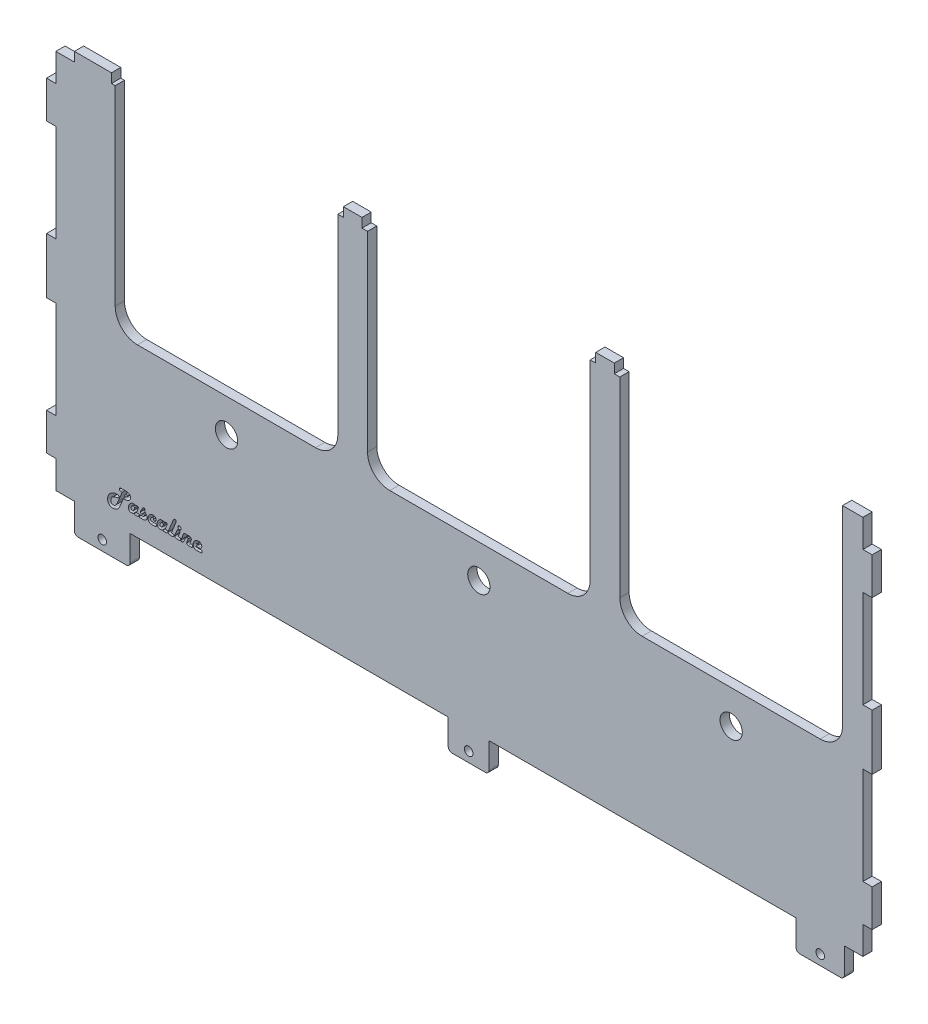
SolidWorks part; units mm, degrees
ref_plane "Front Plane" through (0, 0, 0) normal (0, 0, 1) x (1, 0, 0)
ref_plane "Top Plane" through (0, 0, 0) normal (0, 1, 0) x (1, 0, 0)
ref_plane "Right Plane" through (0, 0, 0) normal (1, 0, 0) x (0, 0, -1)
sketch "Sketch1" plane through (0, 0, 0) normal (0, 0, 1) x (1, 0, 0)
  line L0 (101.6, 130.175) -> (101.6, 0) construction
  line L1 (0, 0) -> (276.225, 0)
  line L2 (0, 0) -> (0, 130.175)
  line L3 (0, 130.175) -> (276.225, 130.175) construction
  line L4 (276.225, 0) -> (276.225, 130.175)
  line L5 (106.68, 130.175) -> (106.68, 57.15)
  line L6 (20.32, 130.175) -> (96.52, 130.175) construction
  line L7 (20.32, 130.175) -> (20.32, 57.15)
  line L8 (20.32, 57.15) -> (96.52, 57.15)
  line L9 (96.52, 130.175) -> (96.52, 57.15)
  line L10 (182.88, 57.15) -> (106.68, 57.15)
  line L11 (182.88, 130.175) -> (182.88, 57.15)
  line L12 (182.88, 130.175) -> (106.68, 130.175) construction
  line L13 (58.42, 45.72) -> (144.78, 45.72) construction
  line L14 (144.78, 45.72) -> (231.14, 45.72) construction
  line L15 (144.78, 130.175) -> (144.78, 0) construction
  line L16 (193.04, 130.175) -> (193.04, 57.15)
  line L17 (269.24, 57.15) -> (193.04, 57.15)
  line L18 (269.24, 130.175) -> (269.24, 57.15)
  line L19 (269.24, 130.175) -> (193.04, 130.175) construction
  line L20 (0, 130.175) -> (20.32, 130.175)
  line L24 (96.52, 130.175) -> (106.68, 130.175)
  line L28 (182.88, 130.175) -> (193.04, 130.175)
  line L32 (269.24, 130.175) -> (276.225, 130.175)
  line L33 (187.96, 130.175) -> (187.96, 0) construction
  circle A0 centre (231.14, 45.72) radius 3.81
  circle A1 centre (58.42, 45.72) radius 3.81
  circle A2 centre (144.78, 45.72) radius 3.81
  point P27 (101.6, 45.72)
  point P28 (58.42, 57.15)
  dimension "D3" = 45.72
  dimension "D5" = 276.225
  dimension "D4" = 7.62
  dimension "D2" = 86.36
  dimension "D7" = 45.085
  dimension "D8" = 5.08
  dimension "D9" = 57.15
  dimension "D11" = 130.175
extrude "Boss-Extrude1" add sketch "Sketch1" along normal blind 3.175
fillet "Fillet1" radius 7.62 6 edges at (20.32, 57.15, 1.5875) (106.68, 57.15, 1.5875) (182.88, 57.15, 1.5875) (96.52, 57.15, 1.5875) (269.24, 57.15, 1.5875) (193.04, 57.15, 1.5875)
sketch "Sketch2" plane through (0, 0, 0) normal (0, 0, 1) x (1, 0, 0)
  line L0 (193.04, 130.175) -> (182.88, 130.175) construction
  line L1 (0, 65.0875) -> (276.225, 65.0875) construction
  line L2 (0, 130.175) -> (0, 0) construction
  line L3 (276.225, 0) -> (276.225, 130.175) construction
  line L4 (138.1125, 0) -> (138.1125, 130.175) construction
  line L5 (184.785, 130.175) -> (191.135, 130.175)
  line L6 (0, 0) -> (276.225, 0) construction
  line L8 (276.225, 130.175) -> (269.24, 130.175) construction
  line L9 (276.225, 120.65) -> (279.4, 120.65)
  line L10 (276.225, 120.65) -> (276.225, 107.95)
  line L11 (276.225, 107.95) -> (279.4, 107.95)
  line L12 (279.4, 120.65) -> (279.4, 107.95)
  line L13 (279.4, 9.525) -> (279.4, 22.225)
  line L14 (184.785, 130.175) -> (184.785, 133.35)
  line L15 (276.225, 22.225) -> (279.4, 22.225)
  line L16 (276.225, 9.525) -> (276.225, 22.225)
  line L17 (276.225, 9.525) -> (279.4, 9.525)
  line L18 (-3.175, 74.6125) -> (-3.175, 55.5625)
  line L19 (276.225, 74.6125) -> (279.4, 74.6125)
  line L20 (276.225, 74.6125) -> (276.225, 55.5625)
  line L21 (276.225, 55.5625) -> (279.4, 55.5625)
  line L22 (279.4, 74.6125) -> (279.4, 55.5625)
  line L23 (0, 55.5625) -> (-3.175, 55.5625)
  line L24 (0, 74.6125) -> (0, 55.5625)
  line L25 (0, 74.6125) -> (-3.175, 74.6125)
  line L26 (0, 9.525) -> (-3.175, 9.525)
  line L27 (0, 9.525) -> (0, 22.225)
  line L28 (0, 22.225) -> (-3.175, 22.225)
  line L29 (-3.175, 9.525) -> (-3.175, 22.225)
  line L30 (-3.175, 120.65) -> (-3.175, 107.95)
  line L31 (0, 107.95) -> (-3.175, 107.95)
  line L32 (0, 120.65) -> (0, 107.95)
  line L33 (0, 120.65) -> (-3.175, 120.65)
  line L34 (106.68, 130.175) -> (96.52, 130.175) construction
  line L35 (6.35, 0) -> (25.4, 0)
  line L36 (6.35, 0) -> (6.35, -10.033)
  line L37 (6.35, -10.033) -> (25.4, -10.033)
  line L38 (25.4, 0) -> (25.4, -10.033)
  line L39 (134.3025, 0) -> (148.2725, 0)
  line L40 (184.785, 133.35) -> (191.135, 133.35)
  line L41 (191.135, 130.175) -> (191.135, 133.35)
  line L42 (20.32, 130.175) -> (0, 130.175) construction
  line L43 (134.3025, 0) -> (134.3025, -10.033)
  line L44 (134.3025, -10.033) -> (148.2725, -10.033)
  line L45 (148.2725, 0) -> (148.2725, -10.033)
  line L46 (253.365, 0) -> (269.875, 0)
  line L47 (253.365, 0) -> (253.365, -10.033)
  line L48 (253.365, -10.033) -> (269.875, -10.033)
  line L49 (269.875, 0) -> (269.875, -10.033)
  line L50 (98.425, 130.175) -> (104.775, 130.175)
  line L51 (98.425, 130.175) -> (98.425, 133.35)
  line L52 (98.425, 133.35) -> (104.775, 133.35)
  line L53 (104.775, 130.175) -> (104.775, 133.35)
  line L54 (106.68, 130.175) -> (96.52, 130.175) construction
  line L55 (106.68, 130.175) -> (96.52, 130.175) construction
  line L56 (6.35, 130.175) -> (19.05, 130.175)
  line L57 (6.35, 130.175) -> (6.35, 133.35)
  line L58 (6.35, 133.35) -> (19.05, 133.35)
  line L59 (19.05, 130.175) -> (19.05, 133.35)
  point P26 (276.225, 65.0875)
  point P51 (141.2875, -10.033)
  point P58 (101.6, 130.175)
  point P61 (101.6, 130.175)
  point P68 (187.96, 130.175)
  point P69 (187.96, 130.175)
  dimension "D1" = 12.7
  dimension "D2" = 3.175
  dimension "D3" = 9.525
  dimension "D4" = 10.033
  dimension "D5" = 6.35
  dimension "D6" = 6.35
  dimension "D7" = 19.05
  dimension "D8" = 16.51
  dimension "D9" = 3.175
  dimension "D10" = 13.97
  dimension "D11" = 19.05
  dimension "D12" = 6.35
  dimension "D13" = 3.175
  dimension "D14" = 6.35
  dimension "D15" = 12.7
extrude "Boss-Extrude2" add sketch "Sketch2" along normal blind 3.175
hole_wizard "#4 Clearance Hole1" positions "Sketch4" profile "Sketch3" hole size "#4" standard "ANSI Inch"
sketch "Sketch4" plane through (0, 0, 3.175) normal (0, 0, 1) x (1, 0, 0)
  line L12 (148.2725, 0) -> (253.365, 0) construction
  line L16 (6.35, -10.033) -> (25.4, -10.033) construction
  line L17 (134.3025, -10.033) -> (148.2725, -10.033) construction
  line L18 (253.365, -10.033) -> (269.875, -10.033) construction
  point P0 (141.2875, -6.604)
  point P2 (261.62, -6.604)
  point P4 (15.875, -6.604)
  point P62 (15.875, -10.033)
  point P65 (141.2875, -10.033)
  point P68 (261.62, -10.033)
  dimension "D1" = 6.604
sketch "Sketch3" plane through (141.2875, -6.604, 3.175) normal (1, 0, 0) x (0, -1, 0)
  line L0 (0, 0) -> (0, 3.1751)
  line L1 (0, 3.1751) -> (1.4732, 3.1751)
  line L2 (1.4732, 3.1751) -> (1.4732, 0)
  line L5 (1.4732, 0) -> (0, 0)
  line L11 (0, -6.35) -> (0, 107.95) construction
  dimension "Thru Hole Dia." = 2.9464
  dimension "Thru Hole Depth" = 3.1751
fillet "Fillet2" radius 1.27 6 edges at (269.875, -10.033, 1.5875) (253.365, -10.033, 1.5875) (148.2725, -10.033, 1.5875) (134.3025, -10.033, 1.5875) (25.4, -10.033, 1.5875) (6.35, -10.033, 1.5875)
sketch "Sketch5" plane through (0, 0, 3.175) normal (0, 0, 1) x (1, 0, 0)
  text T0 "Pascaline" font "Harlow Solid Italic" height in points 18
  dimension "D1" = 17.78
  dimension "D2" = 6.35
extrude "Cut-Extrude1" cut sketch "Sketch5" against normal through all
